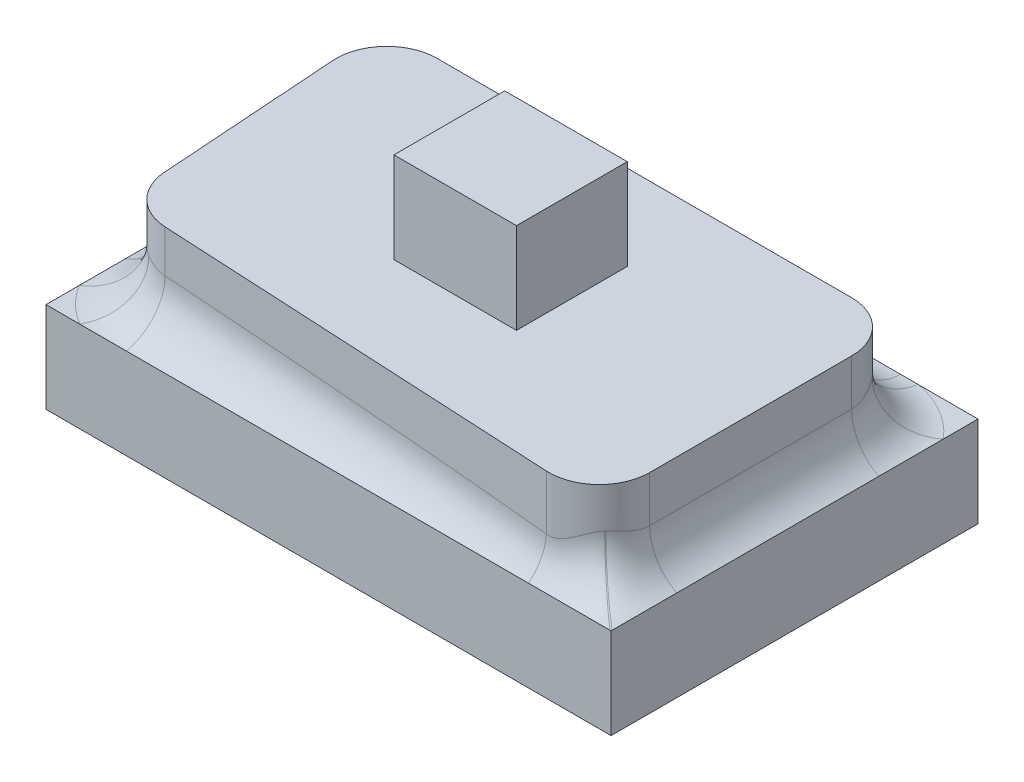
SolidWorks part; units mm, degrees
ref_plane "Front Plane" through (0, 0, 0) normal (0, 0, 1) x (1, 0, 0)
ref_plane "Top Plane" through (0, 0, 0) normal (0, 1, 0) x (1, 0, 0)
ref_plane "Right Plane" through (0, 0, 0) normal (1, 0, 0) x (0, 0, -1)
sketch "Sketch1" plane through (0, 0, 0) normal (0, 1, 0) x (1, 0, 0)
  line L1 (0, 0) -> (56.0446, 0)
  line L2 (0, 0) -> (0, 36.3919)
  line L3 (0, 36.3919) -> (56.0446, 36.3919)
  line L4 (56.0446, 0) -> (56.0446, 36.3919)
extrude "Boss-Extrude1" add sketch "Sketch1" along normal blind 9
sketch "Sketch2" plane through (50.4358, 9, -36.4071) normal (0, 1, 0) x (1, 0, 0)
  line L2 (2.9243, -35.1569) -> (2.9243, -4.8609)
  line L3 (2.9243, -4.8609) -> (-48.5484, -4.8609)
  line L6 (-46.6258, -32.5971) -> (2.9243, -35.1569)
  line L7 (-48.5484, -4.8609) -> (-46.6258, -32.5971)
extrude "Boss-Extrude2" add sketch "Sketch2" along normal blind 9
sketch "Sketch3" plane through (0, 18, 0) normal (0, 1, 0) x (1, 0, 0)
  line L1 (22.3908, 23.1057) -> (34.5461, 23.1057)
  line L2 (22.3908, 23.1057) -> (22.3908, 12.1171)
  line L3 (22.3908, 12.1171) -> (34.5461, 12.1171)
  line L4 (34.5461, 23.1057) -> (34.5461, 12.1171)
extrude "Boss-Extrude3" add sketch "Sketch3" along normal blind 9
fillet "Fillet1" radius 5 4 edges at (1.8874, 13.5, -31.5461) (53.3601, 13.5, -31.5461) (53.3601, 13.5, -1.2502) (3.81, 13.5, -3.81)
fillet "Fillet2" radius 5 4 edges at (4.9874, 9, -5.0083) (3.5902, 9, -29.9572) (51.8956, 9, -30.0817) (51.8032, 9, -2.8896)
